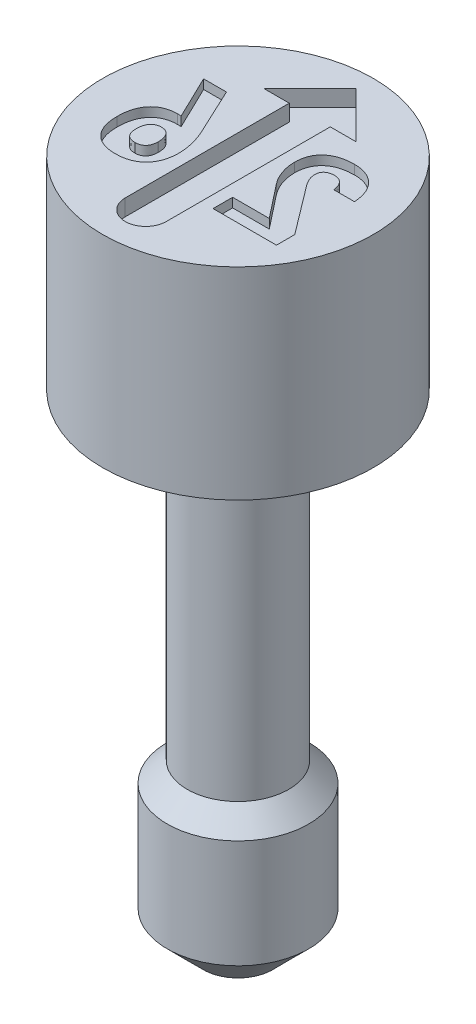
SolidWorks part; units mm, degrees
ref_plane "Front Plane" through (0, 0, 0) normal (0, 0, 1) x (1, 0, 0)
ref_plane "Top Plane" through (0, 0, 0) normal (0, 1, 0) x (1, 0, 0)
ref_plane "Right Plane" through (0, 0, 0) normal (1, 0, 0) x (0, 0, -1)
sketch "Sketch1" plane through (0, 0, 0) normal (0, 0, 1) x (1, 0, 0)
  line L0 (0, 17.018) -> (3.3528, 17.018)
  line L1 (0, -3.6881) -> (0, 3.6881) construction
  line L2 (3.3528, 17.018) -> (3.3528, 12.0142)
  line L3 (3.3528, 12.0142) -> (1.2573, 12.0142)
  line L4 (1.2573, 12.0142) -> (1.2573, 4.064)
  line L5 (1.2573, 4.064) -> (1.7526, 3.5687)
  line L6 (1.7526, 3.5687) -> (1.7526, 0.889)
  line L7 (1.7526, 0.889) -> (0.8636, 0)
  line L8 (3.6881, 0) -> (-3.6881, 0) construction
  line L9 (0.8636, 0) -> (0, 0)
  line L10 (0, 0) -> (0, 17.018)
  line L11 (0, 0) -> (0, 64.9194) construction
  dimension "D1" = 17.018
  dimension "D2" = 4.064
  dimension "D3" = 0.889
  dimension "D4" = 45
  dimension "D5" = 3.5052
  dimension "D6" = 6.7056
  dimension "D7" = 2.5146
  dimension "D8" = 5.0038
revolve "Revolve1" add sketch "Sketch1" angle 360 about L11
sketch "Sketch2" plane through (0, 17.018, 0) normal (0, 1, 0) x (1, 0, 0)
  line L1 (0.508, -2.286) -> (0.508, 1.778)
  line L2 (-0.508, -2.286) -> (-0.508, 1.778)
  line L3 (0, -3.6881) -> (0, 3.6881) construction
  line L4 (-0.508, 1.778) -> (-1.143, 1.778)
  line L5 (0.508, 1.778) -> (1.143, 1.778)
  line L6 (1.143, 1.778) -> (0, 2.921)
  line L7 (0, 2.921) -> (-1.143, 1.778)
  line L8 (-3.6881, 0) -> (3.6881, 0) construction
  arc A0 (-0.508, -2.286) -> (0.508, -2.286) centre (0, -2.286) ccw
  dimension "D6" = 2.286
  dimension "D1" = 1.016
  dimension "D2" = 0.508
  dimension "D3" = 2.286
  dimension "D4" = 1.143
  dimension "D5" = 45
  dimension "D7" = 1.778
extrude "Cut-Extrude1" cut sketch "Sketch2" against normal blind 0.4064
sketch "Sketch3" plane through (0, 17.018, 0) normal (0, 1, 0) x (1, 0, 0)
  text T0 "2 6" font "Bahnschrift" height 2.667
extrude "Cut-Extrude2" cut sketch "Sketch3" against normal blind 0.2286
